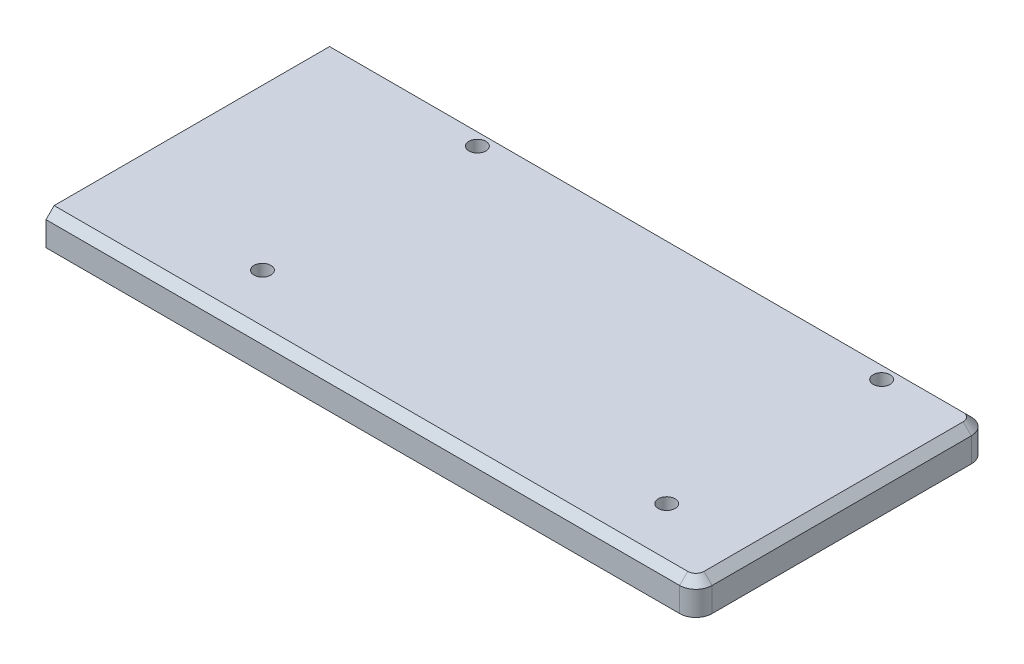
SolidWorks part; units mm, degrees
ref_plane "Front Plane" through (0, 0, 0) normal (0, 0, 1) x (1, 0, 0)
ref_plane "Top Plane" through (0, 0, 0) normal (0, 1, 0) x (1, 0, 0)
ref_plane "Right Plane" through (0, 0, 0) normal (1, 0, 0) x (0, 0, -1)
sketch "Sketch1" plane through (0, 0, 0) normal (0, 1, 0) x (1, 0, 0)
  line L1 (0, 0) -> (127, 0)
  line L2 (0, 0) -> (0, 56.9976)
  line L3 (0, 56.9976) -> (127, 56.9976)
  line L4 (127, 0) -> (127, 56.9976)
  dimension "D1" = 127
  dimension "D2" = 56.9976
extrude "Boss-Extrude1" add sketch "Sketch1" along normal blind 6.35
fillet "Fillet1" radius 3.175 2 edges at (127, 3.175, -56.9976) (127, 3.175, 0)
sketch "Sketch2" plane through (127, 0, 0) normal (1, 0, 0) x (0, 0, -1)
  line L0 (3.175, 3.175) -> (53.8226, 3.175)
  line L1 (3.175, 6.35) -> (3.175, 0) construction
  line L2 (53.8226, 0) -> (53.8226, 6.35) construction
  line L3 (28.4988, 3.175) -> (28.4988, -22.225)
chamfer "Chamfer1" distance 1.5875 angle 45 5 edges at (61.9125, 6.35, -56.9976) (126.0701, 6.35, -56.0677) (127, 6.35, -28.4988) (126.0701, 6.35, -0.9299) (61.9125, 6.35, 0)
sketch "Sketch3" plane through (0, 6.35, 0) normal (0, 1, 0) x (1, 0, 0)
  line L0 (110.3, 51.3976) -> (110.3, 54.5976)
  line L1 (110.3, 9.3976) -> (110.3, 12.5976)
  line L2 (31.3, 9.3976) -> (31.3, 12.5976)
  line L3 (31.3, 51.3976) -> (31.3, 54.5976)
  circle A0 centre (110.3, 52.9976) radius 1.6 construction
  circle A1 centre (110.3, 52.9976) radius 1.651
  circle A2 centre (110.3, 10.9976) radius 1.6 construction
  circle A3 centre (110.3, 10.9976) radius 1.651
  circle A4 centre (31.3, 10.9976) radius 1.6 construction
  circle A5 centre (31.3, 10.9976) radius 1.651
  circle A6 centre (31.3, 52.9976) radius 1.6 construction
  circle A7 centre (31.3, 52.9976) radius 1.651
  dimension "D1" = 3.302
  dimension "D2" = 3.302
  dimension "D3" = 3.302
  dimension "D4" = 3.302
extrude "Cut-Extrude1" cut sketch "Sketch3" against normal through all contours L0 A1 | L0 A1 | L1 A3 | L1 A3 | L2 A5 | L2 A5 | L3 A7 | L3 A7
